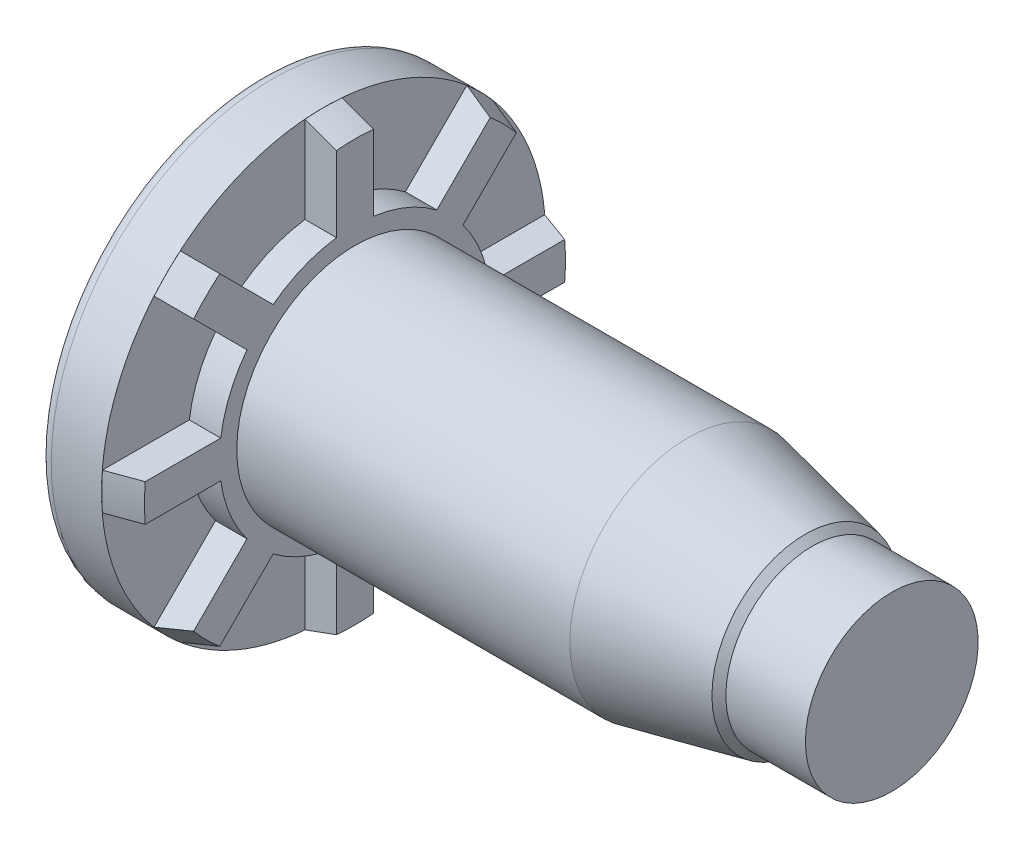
SolidWorks part; units mm, degrees
ref_plane "Plane1" through (0, 0, 0) normal (0, 0, 1) x (1, 0, 0)
ref_plane "Plane2" through (0, 0, 0) normal (0, 1, 0) x (1, 0, 0)
ref_plane "Plane3" through (0, 0, 0) normal (1, 0, 0) x (0, 0, -1)
sketch "BodySke" plane through (0, 0, 0) normal (0, 0, 1) x (1, 0, 0)
  line L0 (-2.1082, 7.0206) -> (-2.1082, 0)
  line L1 (1.0541, 7.0569) -> (1.0541, 3.9624)
  line L2 (0.0025, 7.4397) -> (1.0541, 7.0569)
  line L3 (1.0541, 3.9624) -> (12.2174, 3.9624)
  line L4 (12.2174, 3.9624) -> (16.1493, 3.1293)
  line L5 (19.05, 0) -> (-2.1082, 0)
  line L6 (0, 0) -> (50.554, 0) construction
  line L7 (16.383, 2.8956) -> (19.05, 2.8956)
  line L8 (16.383, 2.8956) -> (16.1493, 3.1293)
  line L9 (-1.6866, 7.4422) -> (0, 7.4422)
  line L10 (0.0025, 7.4397) -> (0, 7.4397)
  line L11 (1.4097, 19.05) -> (1.4097, -3.175) construction
  line L12 (0, 7.4397) -> (0, 7.4422)
  line L13 (19.05, 2.8956) -> (19.05, 0)
  arc A0 (-2.1082, 7.0206) -> (-1.6866, 7.4422) centre (-1.6866, 7.0206) cw
  dimension "D2" = 0.0025
  dimension "Fillet_rad" = 0.4216
  dimension "D1" = 20
  dimension "Diameter" = 7.9248
  dimension "D3" = 0.0025
  dimension "D4" = 45
  dimension "Length" = 19.05
  dimension "Minor_dia" = 6.2586
  dimension "Advance" = 1.4097
  dimension "H_dia" = 14.8844
  dimension "T_dim" = 2.1082
  dimension "Clinch_ht" = 1.0541
  dimension "Dog_len" = 2.667
  dimension "Dog_dia" = 5.7912
  dimension "Thread_trans" = 4.1656
revolve "BaseBody" add sketch "BodySke" angle 360 about L6
sketch "ThdSchSke" plane through (0, 0, 0) normal (0, 0, 1) x (1, 0, 0)
  line L0 (3.937, -3.1293) -> (3.3536, -3.9624)
  line L1 (3.937, -3.1293) -> (4.5204, -3.9624)
  line L2 (4.5204, -3.9624) -> (4.5204, -4.953)
  line L3 (-3.175, 0) -> (5.1513, 0) construction
  line L4 (0, -7.4422) -> (0, 7.4422) construction
  line L5 (4.5204, -4.953) -> (3.3536, -4.953)
  line L6 (3.3536, -4.953) -> (3.3536, -3.9624)
  line L7 (21.9888, 6.5809) -> (21.9888, 1.1961) construction
  dimension "Thread_minor" = 6.2586
  dimension "Diameter" = 7.9248
  dimension "Start" = 3.937
  dimension "SideAngle" = 55
  dimension "VeeAngle" = 70
  dimension "Overcut" = 9.906
  dimension "Thread_length" = 18.0518
revolve "ThreadSchematic" [suppressed] cut sketch "ThdSchSke" angle 360 about L3
pattern_linear "ThdSchPat" [suppressed]
sketch "RibCutSke" plane through (1.0541, 1.7944, -0.091) normal (1, 0, 0) x (0, 0, -1)
  line L0 (0.5289, 2.7055) -> (0.5289, 5.6219)
  line L1 (2.6526, 1.8258) -> (4.7149, 3.888)
  line L2 (0.5289, 2.1192) -> (0.5289, 2.4006) construction
  line L3 (-0.091, -1.7944) -> (-0.091, 5.0239) construction
  line L4 (-0.091, -1.7944) -> (0.5289, 2.1192) construction
  line L5 (-0.091, -1.7944) -> (2.2381, 1.4112) construction
  line L6 (2.2381, 1.4112) -> (2.4421, 1.6153) construction
  arc A1 (2.6526, 1.8258) -> (0.5289, 2.7055) centre (-0.091, -1.7944) ccw
  arc A2 (4.7149, 3.888) -> (0.5289, 5.6219) centre (-0.091, -1.7944) ccw
  circle A3 centre (-0.091, -1.7944) radius 7.0569 construction
  circle A4 centre (-0.091, -1.7944) radius 3.9624 construction
  dimension "Inner_dia" = 9.0847
  dimension "Outer_dia" = 14.8844
  dimension "Rib_root_dia" = 7.9248
  dimension "Rib_root_half_angle" = 9
  dimension "Rib_root_gap_angle" = 27
  dimension "Angle" = 45
extrude "RibCut" cut sketch "RibCutSke" against normal blind 1.0541
pattern_circular "RibCutsPat" count 8 every 45 about axis through (0, 0, 0) along (1, 0, 0) of "RibCut"
equation "' \"Length@BodySke\" = 0.75"
equation "' \"H_dia@BodySke\" = 0.586"
equation "' \"Start@ThdSchSke\" = 0.155"
equation "' \"T_dim@BodySke\" = 0.083"
equation "' \"Dog_dia@BodySke\" = 0.228"
equation "' \"Dog_len@BodySke\" = 0.105"
equation "' \"Thread_trans@BodySke\" = 0.164"
equation "' \"Diameter@BodySke\" = 0.312"
equation "' \"Minor_dia@BodySke\" =  0.2464"
equation "' \"Advance@BodySke\" = 0.0555"
equation "\"Fillet_rad@BodySke\" =  \"T_dim@BodySke\" * 0.2"
equation "\"Clinch_ht@BodySke\" = \"T_dim@BodySke\" * 0.5"
equation "\"Num_ribs@RibCutsPat\" = 8"
equation "\"Angle@RibCutSke\" =\"Angle@RibCutsPat\""
equation "\"Rib_root_half_angle@RibCutSke\" = \"Angle@RibCutSke\" / 5"
equation "\"Rib_root_gap_angle@RibCutSke\" = \"Angle@RibCutSke\" - (2 * \"Rib_root_half_angle@RibCutSke\" )"
equation "\"Rib_root_dia@RibCutSke\" = \"Diameter@BodySke\""
equation "\"Inner_dia@RibCutSke\" = \"Diameter@BodySke\" + ( \"H_dia@BodySke\" - \"Diameter@BodySke\" ) / 6"
equation "\"Outer_dia@RibCutSke\" = \"H_dia@BodySke\""
equation "\"Depth@RibCut\" = \"Clinch_ht@BodySke\""
equation "\"Thread_length@ThreadCosmetic\" = \"Length@BodySke\" - \"Start@ThdSchSke\"  - \"Dog_len@BodySke\"  - ( \"Minor_dia@BodySke\" - \"Dog_dia@BodySke\" ) / 2"
equation "\"Thread_minor@ThreadCosmetic\" = \"Minor_dia@BodySke\""
equation "\"Thread_minor@ThdSchSke\" = \"Minor_dia@BodySke\""
equation "\"Diameter@ThdSchSke\" = \"Diameter@BodySke\""
equation "\"Overcut@ThdSchSke\" = \"Diameter@BodySke\" * 1.25"
equation "\"Num_threads@ThdSchPat\" = int( \"Thread_length@ThreadCosmetic\" / \"Advance@BodySke\" + 0.999 )  + 1"
equation "\"Advance@ThdSchPat\" = \"Thread_length@ThreadCosmetic\" /  (\"Num_threads@ThdSchPat\" - 1) 'relax it"
equation "\"Num_threads@ThdSchPat\" = \"Num_threads@ThdSchPat\" - sgn( \"Num_threads@ThdSchPat\" - 1) '---chamfered tips only---"
